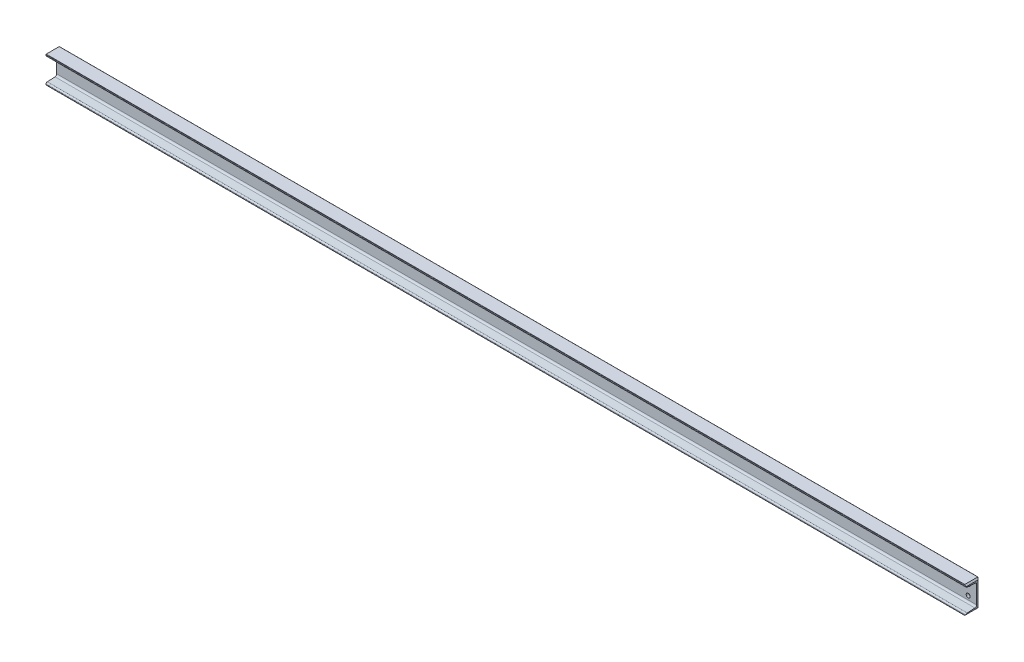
SolidWorks part; units mm, degrees
ref_plane "Plan de face" through (0, 0, 0) normal (0, 0, 1) x (1, 0, 0)
ref_plane "Plan de dessus" through (0, 0, 0) normal (0, 1, 0) x (1, 0, 0)
ref_plane "Plan de droite" through (0, 0, 0) normal (1, 0, 0) x (0, 0, -1)
ref_plane "Plan1" through (0, 0, 30) normal (0, 0, 1) x (1, 0, 0)
sketch "Esquisse1" plane through (0, 0, 30) normal (0, 0, 1) x (1, 0, 0)
  line L0 (-1030, 30) -> (-1030, -30)
  line L1 (-1030, -30) -> (1030, -30)
  line L2 (1030, -30) -> (1030, 30)
  line L3 (1030, 30) -> (-1030, 30)
extrude "Boss.-Extru.1" add sketch "Esquisse1" against normal blind 30
sketch "Esquisse2" plane through (-1030, 0, 0) normal (-1, 0, 0) x (0, 0, 1)
  line L0 (30, 23.8013) -> (6, 23.8013)
  line L1 (6, 23.8013) -> (6, -23.8013)
  line L2 (6, -23.8013) -> (30, -23.8013)
  line L3 (30, -23.8013) -> (30, 23.8013)
extrude "Enlèv. mat.-Extru.1" cut sketch "Esquisse2" against normal through all
draft "Dépouille1" type of draft neutral plane draft angle 3 faces to draft 2 parameters "D1"=3
hole_wizard "Diamètre du perçage Ø9.0 (9)1" positions "Esquisse4" profile "Esquisse3" hole size "Ø9.0" standard "Ansi Metric"
sketch "Esquisse4" plane through (0, 0, 6) normal (0, 0, 1) x (1, 0, 0)
  point P0 (1011, -11.25)
  point P1 (1011, 11.25)
sketch "Esquisse3" plane through (1011, -11.25, 6) normal (1, 0, 0) x (0, -1, 0)
  line L0 (0, 0) -> (0, 6)
  line L1 (0, 6) -> (4.5, 6)
  line L2 (4.5, 6) -> (4.5, 0)
  line L5 (4.5, 0) -> (0, 0)
  line L11 (0, -6.35) -> (0, 107.95) construction
  dimension "Diamètre du perçage jusqu'au prochain" = 9
  dimension "Profondeur du perçage jusqu'au prochain" = 6
chamfer "Chanfrein1" distance 3 angle 45 3 edges at (1030, 30, 15) (1030, -30, 15) (1030, 0, 0)
fillet "Congé1" radius 0.5 4 edges at (-1.5, -30, 30) (-1.5, 30, 30) (-1.5, -30, 0) (-1.5, 30, 0)
fillet "Congé2" radius 3 2 edges at (0, -25.0591, 30) (0, 25.0591, 30)
fillet "Congé3" radius 4 2 edges at (0, -23.8013, 6) (0, 23.8013, 6)
